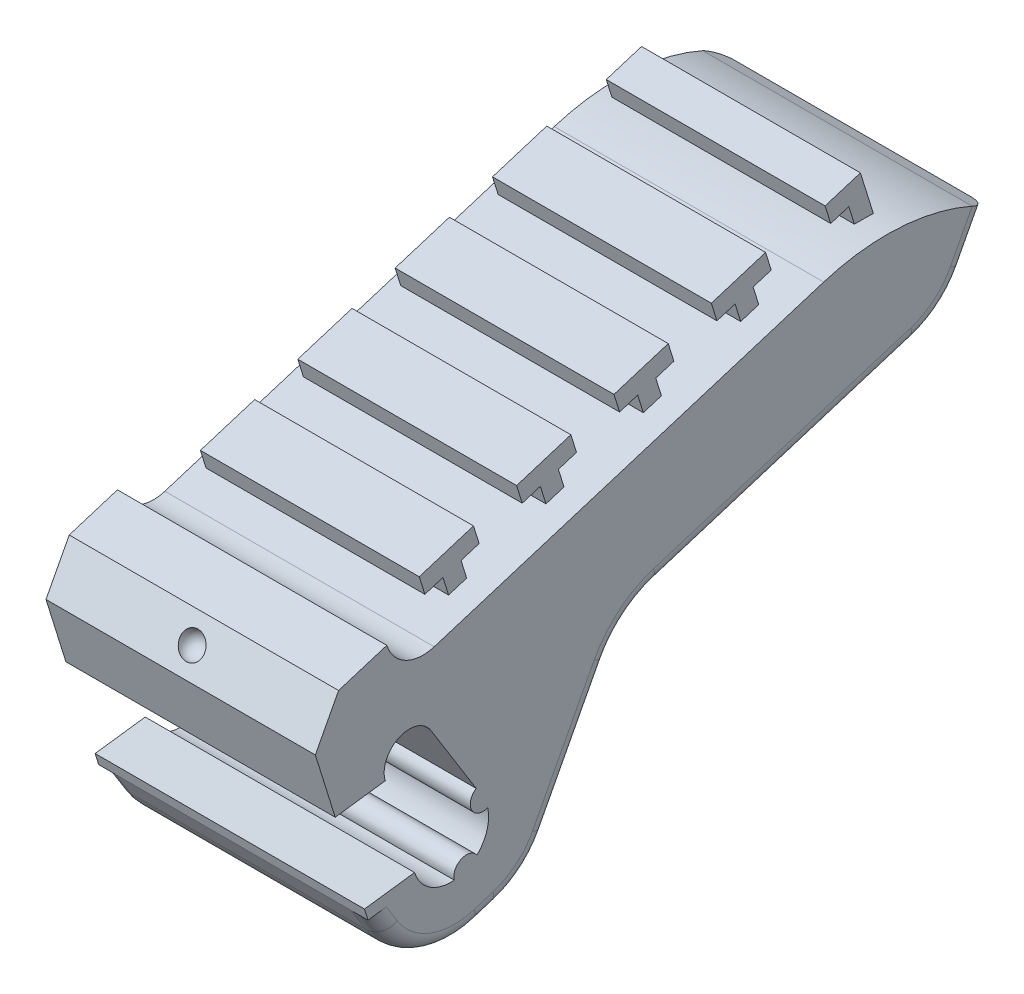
SolidWorks part; units mm, degrees
other "<finger_pivot_print>-<Contouring>"
ref_plane "Front Plane" through (0, 0, 0) normal (0, 0, 1) x (1, 0, 0)
ref_plane "Top Plane" through (0, 0, 0) normal (0, 1, 0) x (1, 0, 0)
ref_plane "Right Plane" through (0, 0, 0) normal (1, 0, 0) x (0, 0, -1)
inserted part "finger_pivot_print"
sketch "Sketch1" plane through (8, 0, 0) normal (1, 0, 0) x (0, 0, -1)
  line L0 (69.5237, -1.9065) -> (70.6122, -1.7632) construction
  line L1 (95.9203, 19.536) -> (101.3462, 21.2234)
  line L2 (69.5237, -1.9065) -> (70.4099, -3.3314) construction
  line L3 (76.1405, -5.4653) -> (77.2414, -5.1229) construction
  line L4 (80.1826, -2.6747) -> (83.8419, 4.2878) construction
  line L5 (86.7831, 6.7361) -> (102.0572, 11.486) construction
  line L6 (104.9984, 13.9342) -> (106.3109, 16.4315) construction
  line L7 (101.3462, 21.2234) -> (105.4064, 16.8833)
  line L29 (95.0443, 22.353) -> (71.9106, 15.1589) construction
  line L30 (69.9697, 11.466) -> (67.7735, 10.783) construction
  line L31 (67.7735, 10.783) -> (66.3939, 8.1581) construction
  line L32 (66.3939, 8.1581) -> (67.3638, 5.0391) construction
  line L33 (67.3638, 5.0391) -> (56.5464, 3.615) construction
  line L34 (56.5464, 3.615) -> (56.5464, 5.3249) construction
  line L35 (56.5464, 5.3249) -> (52.8714, 9) construction
  line L36 (52.8714, 9) -> (50.5714, 9) construction
  line L37 (47.6214, 11.95) -> (11.95, 11.95) construction
  line L38 (55.4757, -3.756) -> (70.6122, -1.7632) construction
  line L39 (9, 9) -> (0, 9) construction
  line L40 (0, -9) -> (6.9289, -9) construction
  line L41 (10.4645, -7.5355) -> (16.5355, -1.4645) construction
  line L42 (20.0711, 0) -> (36.9754, 0) construction
  line L43 (40.5109, -1.4645) -> (46.582, -7.5355) construction
  line L44 (50.1175, -9) -> (51.2765, -9) construction
  line L45 (55.4757, -3.756) -> (56.5464, -3.615) construction
  line L46 (56.113, -5.268) -> (56.5464, -3.615) construction
  line L47 (69.5237, -1.9065) -> (70.6122, -1.7632)
  line L48 (69.5237, -1.9065) -> (70.4099, -3.3314)
  line L49 (76.1405, -5.4653) -> (77.2414, -5.1229)
  line L50 (80.1826, -2.6747) -> (83.8419, 4.2878)
  line L51 (86.7831, 6.7361) -> (102.0572, 11.486)
  line L52 (104.9984, 13.9342) -> (106.3109, 16.4315)
  line L53 (95.0443, 22.353) -> (71.9106, 15.1589)
  line L67 (69.9697, 11.466) -> (67.7735, 10.783)
  line L68 (67.7735, 10.783) -> (66.3939, 8.1581)
  line L69 (66.3939, 8.1581) -> (67.3638, 5.0391)
  line L70 (67.3638, 5.0391) -> (56.5464, 3.615)
  line L71 (56.5464, 3.615) -> (56.5464, 5.3249)
  line L72 (56.5464, 5.3249) -> (52.8714, 9)
  line L73 (52.8714, 9) -> (50.5714, 9)
  line L74 (47.6214, 11.95) -> (11.95, 11.95)
  line L75 (55.4757, -3.756) -> (70.6122, -1.7632)
  line L76 (9, 9) -> (0, 9)
  line L77 (0, -9) -> (6.9289, -9)
  line L78 (10.4645, -7.5355) -> (16.5355, -1.4645)
  line L79 (20.0711, 0) -> (36.9754, 0)
  line L80 (40.5109, -1.4645) -> (46.582, -7.5355)
  line L81 (50.1175, -9) -> (51.2765, -9)
  line L82 (55.4757, -3.756) -> (56.5464, -3.615)
  line L83 (56.113, -5.268) -> (56.5464, -3.615)
  line L84 (9, 9) -> (50.5714, 9)
  line L85 (95.2522, 21.6845) -> (96.5884, 17.3875) construction
  line L86 (69.9697, 11.466) -> (95.9203, 19.536)
  line L88 (105.4064, 16.8833) -> (106.3109, 16.4315)
  line L89 (56.5464, 3.615) -> (56.5464, -3.615)
  line L90 (67.3638, 5.0391) -> (69.5237, -1.9065)
  arc A0 (105.4064, 16.8833) -> (95.2522, 21.6845) centre (97.7168, 13.7589) ccw construction
  arc A4 (70.4099, -3.3314) -> (76.1405, -5.4653) centre (74.6558, -0.6908) ccw construction
  arc A5 (77.2414, -5.1229) -> (80.1826, -2.6747) centre (75.7567, -0.3485) ccw construction
  arc A6 (86.7831, 6.7361) -> (83.8419, 4.2878) centre (88.2679, 1.9616) ccw construction
  arc A21 (102.0572, 11.486) -> (104.9984, 13.9342) centre (100.5725, 16.2604) ccw construction
  arc A22 (106.3109, 16.4315) -> (105.8272, 17.6606) centre (97.7168, 13.7589) ccw construction
  arc A23 (105.8272, 17.6606) -> (95.0443, 22.353) centre (97.7168, 13.7589) ccw construction
  arc A24 (71.9106, 15.1589) -> (69.9697, 11.466) centre (72.7866, 12.342) ccw construction
  arc A25 (50.5714, 9) -> (47.6214, 11.95) centre (47.6214, 9) ccw construction
  arc A26 (11.95, 11.95) -> (9.1747, 8) centre (11.95, 9) ccw construction
  arc A27 (9, 9) -> (9.1747, 8) centre (11.95, 9) ccw construction
  arc A28 (0, 9) -> (0, -9) centre (0, 0) ccw construction
  arc A29 (6.9289, -9) -> (10.4645, -7.5355) centre (6.9289, -4) ccw construction
  arc A30 (20.0711, 0) -> (16.5355, -1.4645) centre (20.0711, -5) ccw construction
  arc A31 (40.5109, -1.4645) -> (36.9754, 0) centre (36.9754, -5) ccw construction
  arc A32 (46.582, -7.5355) -> (50.1175, -9) centre (50.1175, -4) ccw construction
  arc A33 (51.2765, -9) -> (56.113, -5.268) centre (51.2765, -4) ccw construction
  arc A34 (70.4099, -3.3314) -> (76.1405, -5.4653) centre (74.6558, -0.6908) ccw
  arc A35 (77.2414, -5.1229) -> (80.1826, -2.6747) centre (75.7567, -0.3485) ccw
  arc A47 (86.7831, 6.7361) -> (83.8419, 4.2878) centre (88.2679, 1.9616) ccw
  arc A48 (102.0572, 11.486) -> (104.9984, 13.9342) centre (100.5725, 16.2604) ccw
  arc A49 (106.3109, 16.4315) -> (105.8272, 17.6606) centre (97.7168, 13.7589) ccw
  arc A50 (105.8272, 17.6606) -> (95.0443, 22.353) centre (97.7168, 13.7589) ccw
  arc A51 (71.9106, 15.1589) -> (69.9697, 11.466) centre (72.7866, 12.342) ccw
  arc A52 (50.5714, 9) -> (47.6214, 11.95) centre (47.6214, 9) ccw
  arc A53 (11.95, 11.95) -> (9.1747, 8) centre (11.95, 9) ccw
  arc A54 (9, 9) -> (9.1747, 8) centre (11.95, 9) ccw
  arc A55 (0, 9) -> (0, -9) centre (0, 0) ccw
  arc A56 (6.9289, -9) -> (10.4645, -7.5355) centre (6.9289, -4) ccw
  arc A57 (20.0711, 0) -> (16.5355, -1.4645) centre (20.0711, -5) ccw
  arc A58 (40.5109, -1.4645) -> (36.9754, 0) centre (36.9754, -5) ccw
  arc A59 (46.582, -7.5355) -> (50.1175, -9) centre (50.1175, -4) ccw
  arc A60 (51.2765, -9) -> (56.113, -5.268) centre (51.2765, -4) ccw
extrude "Piece Cut" cut sketch "Sketch1" against normal through all
ref_point "Ref Center"
